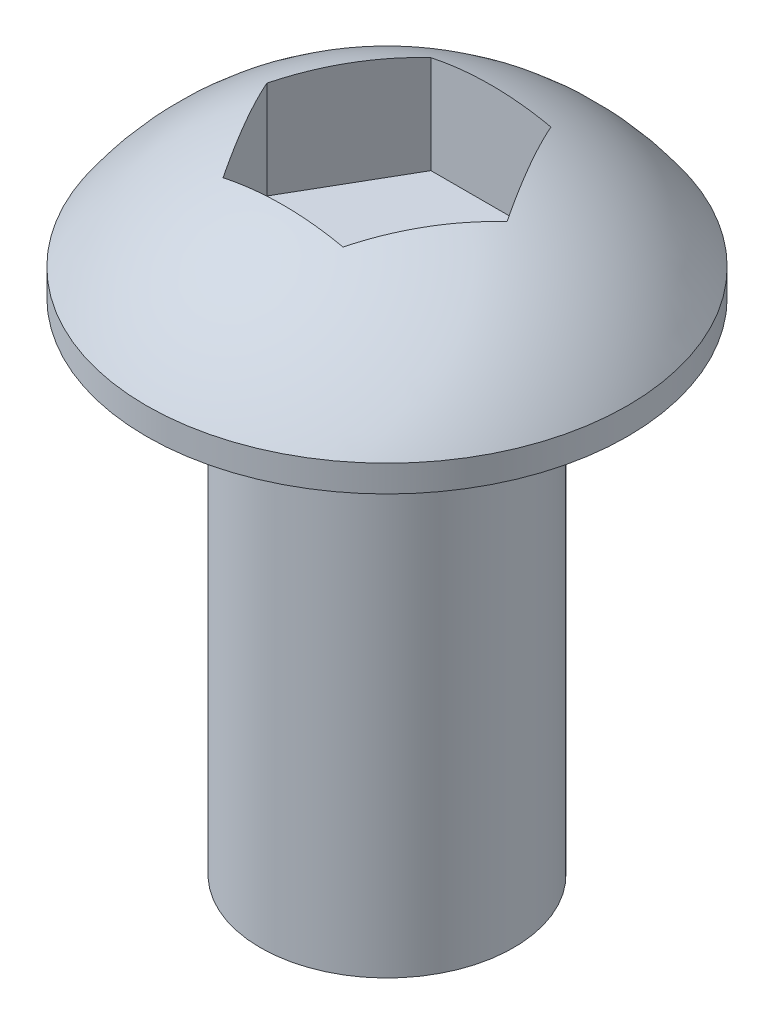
SolidWorks part; units mm, degrees
ref_plane "Front" through (0, 0, 0) normal (0, 0, 1) x (1, 0, 0)
ref_plane "Top" through (0, 0, 0) normal (0, 1, 0) x (1, 0, 0)
ref_plane "Right" through (0, 0, 0) normal (1, 0, 0) x (0, 0, -1)
sketch "Sketch1" plane through (0, 0, 0) normal (0, 0, 1) x (1, 0, 0)
  line L0 (0, 0) -> (4.5847, 0)
  line L1 (4.5847, 0) -> (4.5847, 0.508)
  line L2 (0, -50) -> (0, 50) construction
  line L3 (0, 2.5654) -> (0, 0)
  line L4 (50, 0) -> (-50, 0) construction
  line L5 (0, 2.5654) -> (1.8484, 2.5654)
  line L6 (0, -0.6663) -> (0, -7.9229) construction
  arc A0 (4.5847, 0.508) -> (1.8484, 2.5654) centre (0.1322, -2.5654) ccw
  dimension "D3" = 10.8204
  dimension "D1" = 4.5847
  dimension "D2" = 0.508
  dimension "D4" = 2.5654
  dimension "D5" = 2.5654
revolve "Base-Revolve" add sketch "Sketch1" angle 360 about L6
sketch "Sketch2" plane through (0, 2.5654, 0) normal (0, 1, 0) x (-1, 0, 0)
  line L1 (1.1438, -1.9812) -> (2.2877, 0)
  line L2 (2.2877, 0) -> (1.1438, 1.9812)
  line L3 (1.1438, 1.9812) -> (-1.1438, 1.9812)
  line L4 (-1.1438, 1.9812) -> (-2.2877, 0)
  line L5 (-2.2877, 0) -> (-1.1438, -1.9812)
  line L6 (-1.1438, -1.9812) -> (1.1438, -1.9812)
  circle A0 centre (0, 0) radius 1.9812 construction
  dimension "D1" = 3.9624
extrude "Cut-Extrude1" cut sketch "Sketch2" against normal blind 2.032
sketch "Sketch3" plane through (0, 0, 0) normal (0, -1, 0) x (1, 0, 0)
  circle A0 centre (0, 0) radius 2.413
  dimension "D1" = 4.826
extrude "Boss-Extrude1" add sketch "Sketch3" along normal blind 9.525
